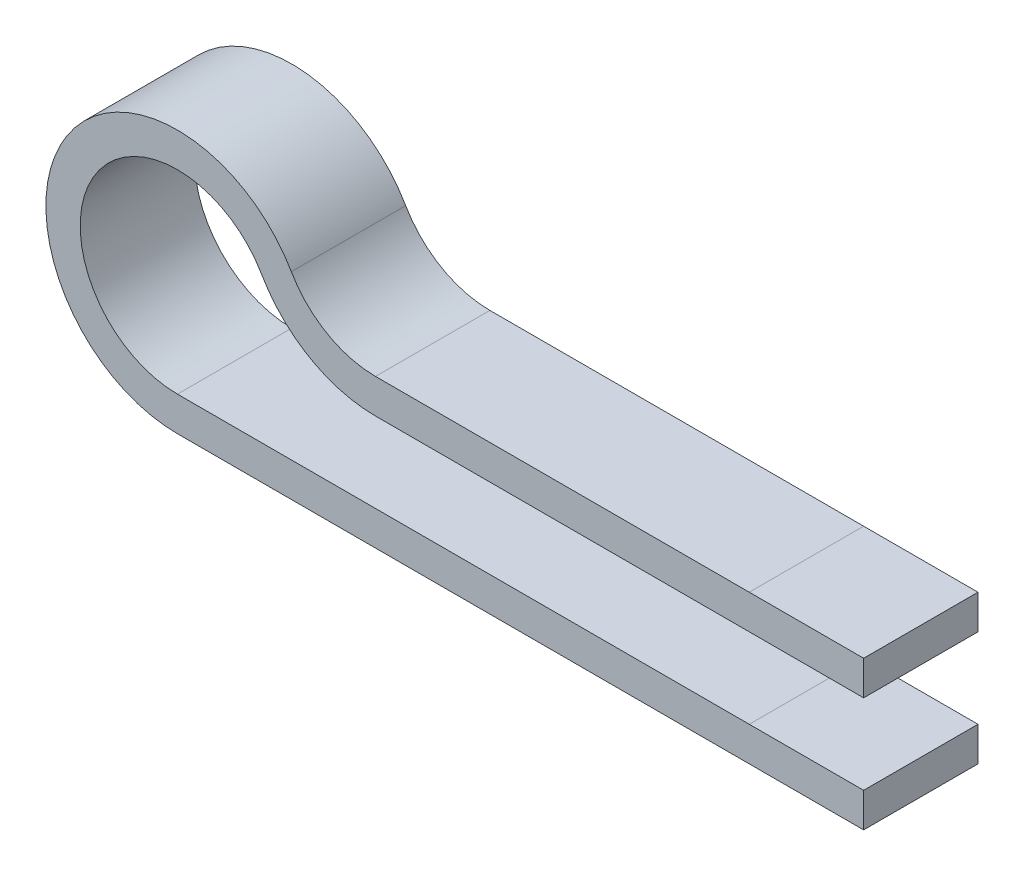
SolidWorks part; units mm, degrees
ref_plane "Front" through (0, 0, 0) normal (0, 0, 1) x (1, 0, 0)
ref_plane "Top" through (0, 0, 0) normal (0, 1, 0) x (1, 0, 0)
ref_plane "Right" through (0, 0, 0) normal (1, 0, 0) x (0, 0, -1)
sketch "Sketch1" plane through (0, 0, 0) normal (0, 0, 1) x (1, 0, 0)
  line L0 (0, 0) -> (30, 0)
  line L1 (8.6603, 5) -> (30, 5)
  line L3 (30, -44.9382) -> (30, 41.6134) construction
  arc A0 (4.3301, 7.5) -> (0, 0) centre (0, 5) ccw
  arc A1 (4.3301, 7.5) -> (8.6603, 5) centre (8.6603, 10) ccw
  dimension "D1" = 10
  dimension "D3" = 30
  dimension "D4" = 5
ref_plane "Plane1" through (30, 0, 0) normal (1, 0, 0) x (0, 0, -1)
sketch "Sketch2" plane through (30, 0, 0) normal (1, 0, 0) x (0, 0, -1)
  line L0 (-106.2603, 0) -> (108.8076, 0) construction
  line L1 (0, -44.9382) -> (0, 114.9253) construction
  line L2 (0, -44.9382) -> (0, 41.6134) construction
  line L4 (-2.5, 0.75) -> (2.5, 0.75)
  line L5 (-2.5, 0.75) -> (-2.5, -0.75)
  line L6 (-2.5, -0.75) -> (2.5, -0.75)
  line L7 (2.5, 0.75) -> (2.5, -0.75)
  dimension "D1" = 5
  dimension "D2" = 2.5
  dimension "D3" = 1.5
  dimension "D4" = 0.75
sweep "Base-Sweep" add profiles "Sketch2" path "Sketch1"
sketch "Sketch3" plane through (0, -0.75, 0) normal (0, -1, 0) x (1, 0, 0)
  line L0 (25, 2.5) -> (25, -2.5)
  line L1 (30, 2.5) -> (30, -2.5) construction
  line L2 (0, 2.5) -> (30, 2.5) construction
  line L3 (0, -2.5) -> (30, -2.5) construction
  dimension "D1" = 5
imported_body "Imported1" [suppressed]
